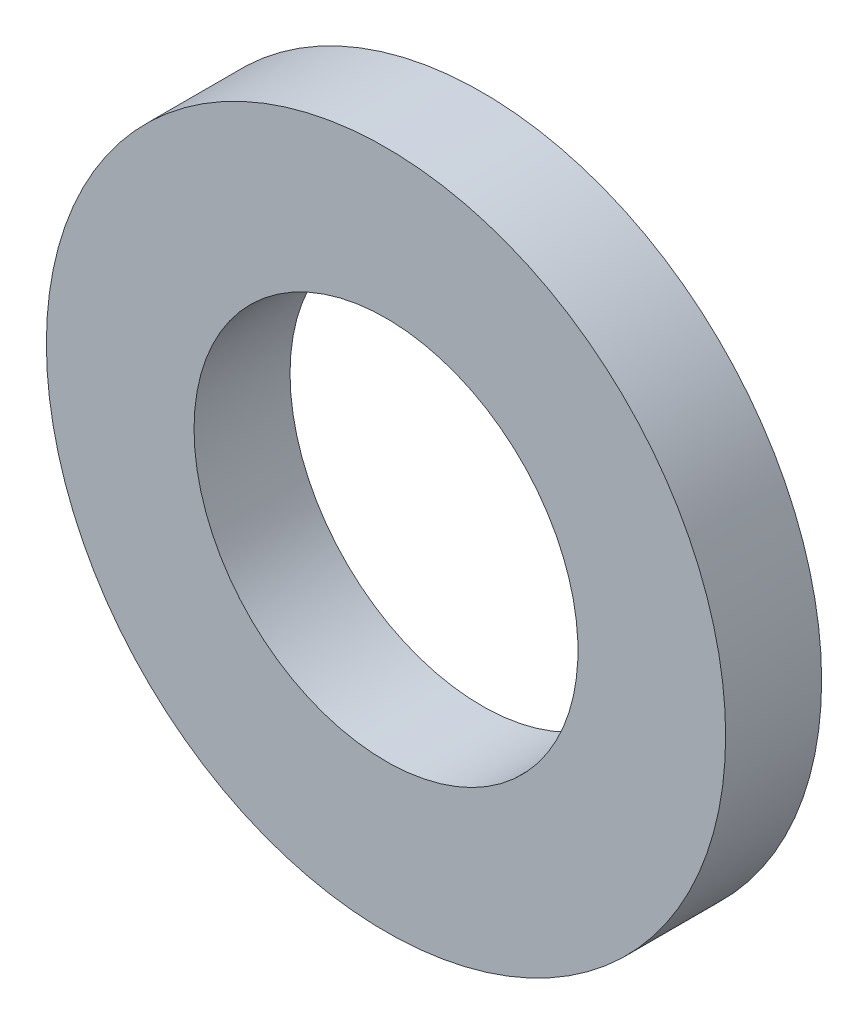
SolidWorks part; units mm, degrees
ref_plane "Front Plane" through (0, 0, 0) normal (0, 0, 1) x (1, 0, 0)
ref_plane "Top Plane" through (0, 0, 0) normal (0, 1, 0) x (1, 0, 0)
ref_plane "Right Plane" through (0, 0, 0) normal (1, 0, 0) x (0, 0, -1)
sketch "Sketch1" plane through (0, 0, 0) normal (0, 0, 1) x (1, 0, 0)
  circle A0 centre (0, 0) radius 3.302
  circle A1 centre (0, 0) radius 5.842
  dimension "D1" = 6.604
  dimension "D2" = 11.684
extrude "Boss-Extrude1" add sketch "Sketch1" along normal blind 1.651
